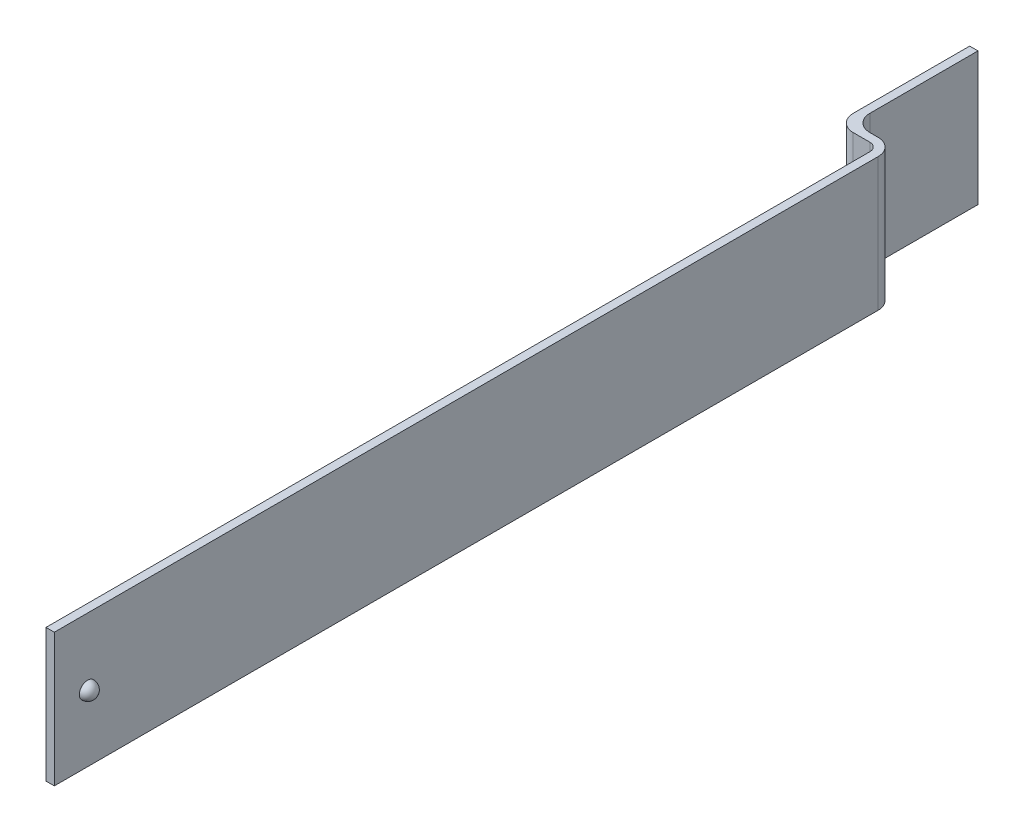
SolidWorks part; units mm, degrees
ref_plane "Plan de face" through (0, 0, 0) normal (0, 0, 1) x (1, 0, 0)
ref_plane "Plan de dessus" through (0, 0, 0) normal (0, 1, 0) x (1, 0, 0)
ref_plane "Plan de droite" through (0, 0, 0) normal (1, 0, 0) x (0, 0, -1)
sketch "Esquisse1" plane through (0, 0, 0) normal (0, 0, 1) x (1, 0, 0)
  line L1 (0, 0) -> (0.5, 0)
  line L2 (0, 0) -> (0, 8)
  line L3 (0, 8) -> (0.5, 8)
  line L4 (0.5, 0) -> (0.5, 8)
  dimension "D1" = 0.5
  dimension "D2" = 8
extrude "Extrusion1" add sketch "Esquisse1" along normal blind 50
sketch "Esquisse2" plane through (0, 0, 0) normal (0, 1, 0) x (1, 0, 0)
  line L0 (0.5, 0) -> (0.5, 0.5)
  line L1 (0.5, 0.5) -> (-2, 0.5)
  line L2 (-2, 0.5) -> (-2, 8)
  line L3 (0, 0) -> (-2.5, 0)
  line L4 (-2.5, 0) -> (-2.5, 8)
  line L5 (0, 0) -> (0.5, 0)
  line L6 (-2.5, 8) -> (-2, 8)
  dimension "D1" = 0.5
  dimension "D2" = 0.5
  dimension "D3" = 8
  dimension "D4" = 3
extrude "Extrusion2" add sketch "Esquisse2" along normal up to surface (8 mm away)
fillet "Congé1" radius 1 3 edges at (-2.5, 4, 0) (-2, 4, -0.5) (0.5, 4, -0.5)
fillet "Congé2" radius 0.5 1 edges
ref_plane "Plan1" through (0, 4, 0) normal (0, -1, 0) x (1, 0, 0)
sketch "Esquisse4" plane through (0, 4, 0) normal (0, -1, 0) x (1, 0, 0)
  line L0 (0.5, 48) -> (8.3769, 48) construction
  line L1 (0.5, 50) -> (0.5, 0.5) construction
  line L2 (0.5, 50) -> (0, 50) construction
  line L3 (0.5, 48.5) -> (0.5, 48)
  line L4 (0.5, 48) -> (1, 48)
  arc A0 (1, 48) -> (0.5, 48.5) centre (0.5, 48) ccw
  point P4 (0.25, 50)
  dimension "D2" = 1
  dimension "D1" = 2
revolve "Révolution1" add sketch "Esquisse4" angle 360 about L0
